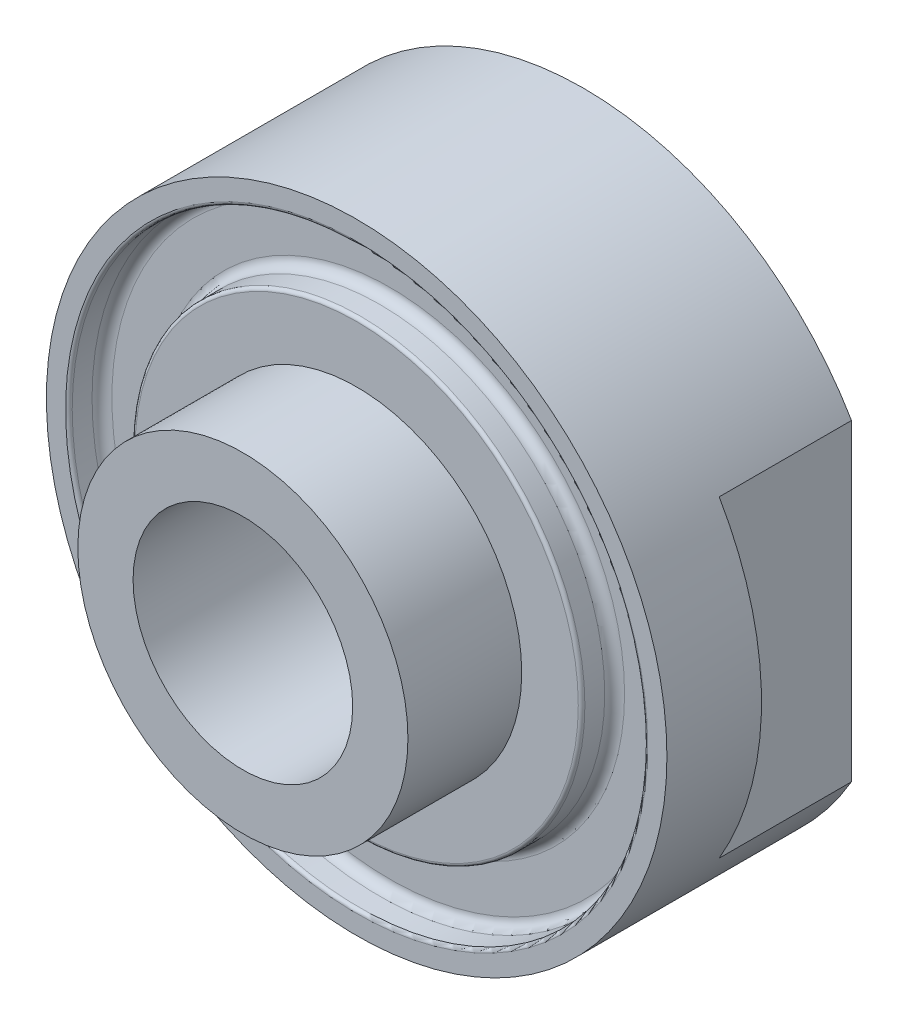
SolidWorks part; units mm, degrees
ref_plane "Front" through (0, 0, 0) normal (0, 0, 1) x (1, 0, 0)
ref_plane "Top" through (0, 0, 0) normal (0, 1, 0) x (1, 0, 0)
ref_plane "Right" through (0, 0, 0) normal (1, 0, 0) x (0, 0, -1)
sketch "Sketch1" plane through (0, 0, 0) normal (0, 0, 1) x (1, 0, 0)
  circle A0 centre (0, 0) radius 11.9126
  dimension "D1" = 23.8252
extrude "Base-Extrude" add sketch "Sketch1" along normal blind 8.7122
sketch "Sketch2" plane through (0, 0, 8.7122) normal (0, 0, 1) x (1, 0, 0)
  circle A0 centre (0, 0) radius 6.3373
  dimension "D1" = 12.6746
extrude "Boss-Extrude1" add sketch "Sketch2" along normal blind 4.3688
sketch "Sketch3" plane through (0, 0, 13.081) normal (0, 0, 1) x (1, 0, 0)
  circle A0 centre (0, 0) radius 4.2164
  dimension "D1" = 8.4328
extrude "Cut-Extrude1" cut sketch "Sketch3" against normal through all
sketch "Sketch4" plane through (0, 0, 8.7122) normal (0, 0, 1) x (1, 0, 0)
  circle A0 centre (0, 0) radius 8.636
  circle A1 centre (0, 0) radius 11.049
  dimension "D1" = 17.272
  dimension "D2" = 2.413
extrude "Cut-Extrude2" cut sketch "Sketch4" against normal blind 1.27
fillet "Fillet1" radius 0.381
fillet "Fillet2" radius 0.127
sketch "Sketch5" plane through (0, 0, 0) normal (0, 0, -1) x (-1, 0, 0)
  line L0 (0, 13.006) -> (0, -13.1441) construction
  line L1 (10.287, 13.006) -> (10.287, -13.1441)
  line L2 (-10.287, 13.006) -> (-10.287, -13.1441)
  line L3 (10.287, 13.006) -> (26.0683, 13.006)
  line L4 (26.0683, 13.006) -> (26.0683, -13.1441)
  line L5 (26.0683, -13.1441) -> (10.287, -13.1441)
  line L6 (-10.287, 13.006) -> (-24.3932, 13.006)
  line L7 (-24.3932, 13.006) -> (-24.3932, -13.1441)
  line L8 (-24.3932, -13.1441) -> (-10.287, -13.1441)
  dimension "D1" = 10.287
  dimension "D2" = 10.287
extrude "Cut-Extrude3" cut sketch "Sketch5" against normal blind 5.08
